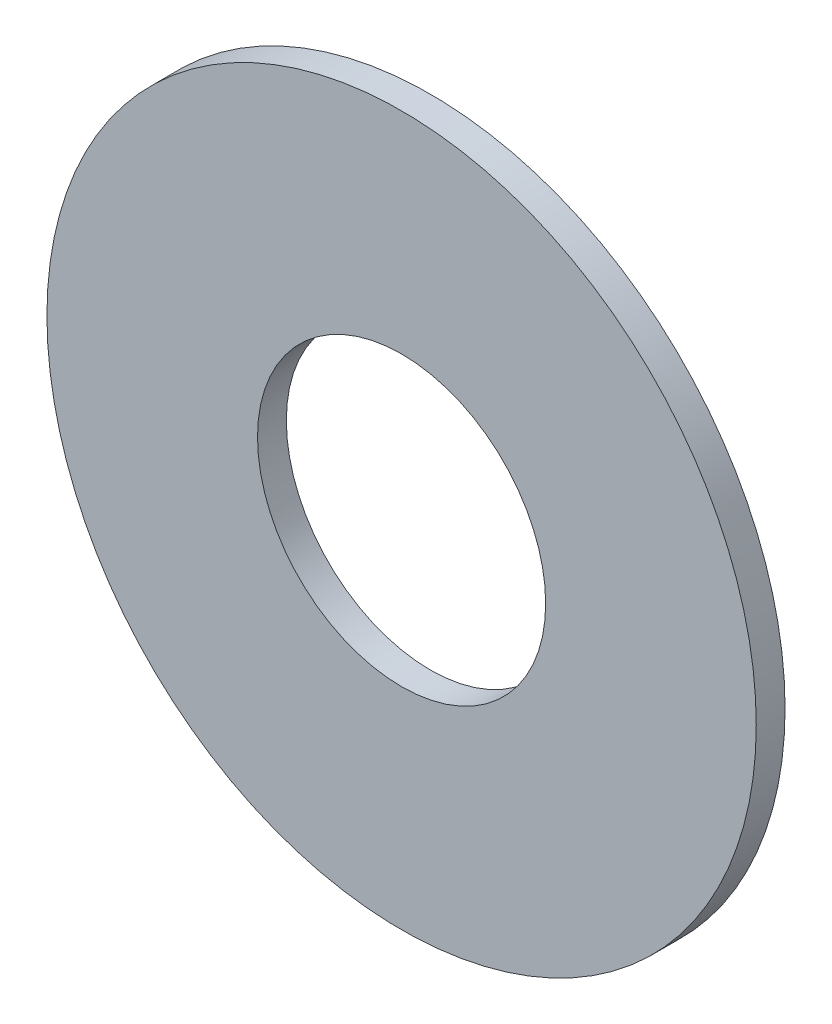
SolidWorks part; units mm, degrees
ref_plane "Plan de face" through (0, 0, 0) normal (0, 0, 1) x (1, 0, 0)
ref_plane "Plan de dessus" through (0, 0, 0) normal (0, 1, 0) x (1, 0, 0)
ref_plane "Plan de droite" through (0, 0, 0) normal (1, 0, 0) x (0, 0, -1)
sketch "Esquisse1" plane through (0, 0, 0) normal (0, 0, 1) x (1, 0, 0)
  circle A0 centre (0, 0) radius 6.5
  circle A1 centre (0, 0) radius 16
  dimension "D1" = 13
  dimension "D2" = 32
extrude "Extrusion1" add sketch "Esquisse1" along normal blind 1.3
